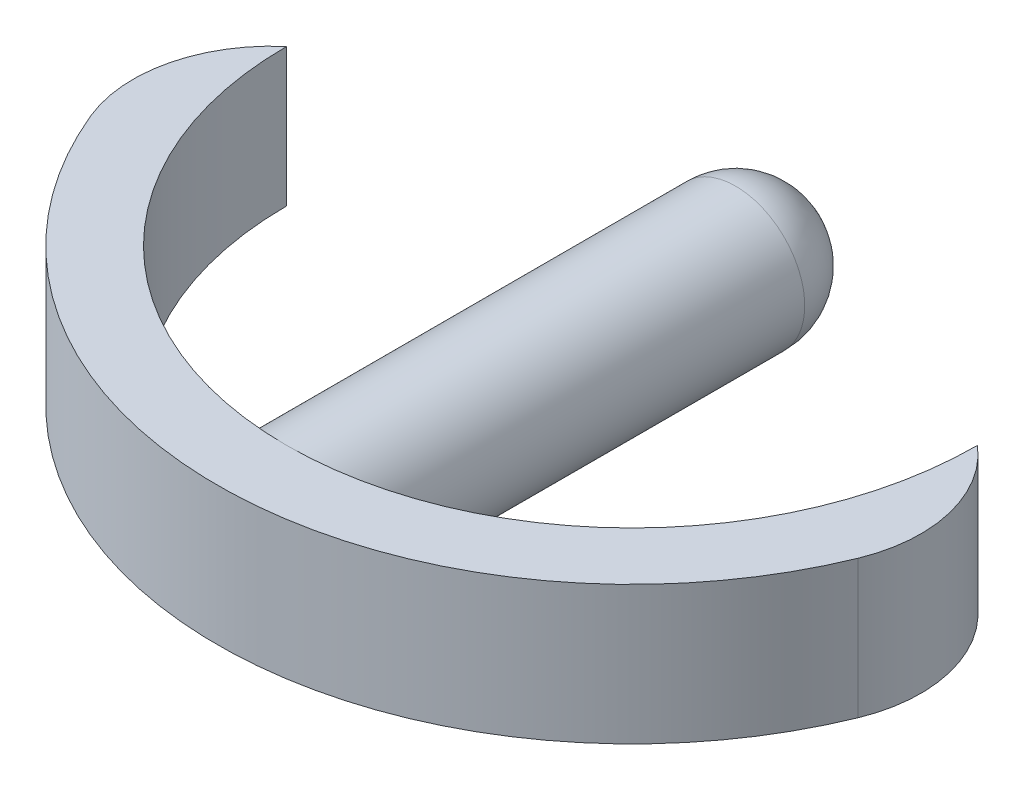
SolidWorks part; units mm, degrees
ref_plane "Front Plane" through (0, 0, 0) normal (0, 0, 1) x (1, 0, 0)
ref_plane "Top Plane" through (0, 0, 0) normal (0, 1, 0) x (1, 0, 0)
ref_plane "Right Plane" through (0, 0, 0) normal (1, 0, 0) x (0, 0, -1)
sketch "Sketch1" plane through (0, 0, 0) normal (0, 1, 0) x (1, 0, 0)
  circle A0 centre (0, 0) radius 7.62
  dimension "D1" = 15.24
extrude "Boss-Extrude1" add sketch "Sketch1" along normal blind 2.54
sketch "Sketch2" plane through (0, 2.54, 0) normal (0, 1, 0) x (1, 0, 0)
  line L0 (-7.62, 0) -> (7.62, 0)
  line L1 (-7.62, 0) -> (-7.62, 9.2593)
  line L2 (7.62, 0) -> (7.62, 9.2593)
  line L3 (-7.62, 9.2593) -> (7.62, 9.2593)
  circle A0 centre (0, 0) radius 7.62 construction
extrude "Cut-Extrude1" cut sketch "Sketch2" against normal through all
sketch "Sketch3" plane through (0, 2.54, 0) normal (0, 1, 0) x (1, 0, 0)
  line L0 (-7.62, 0) -> (7.62, 0) construction
  circle A0 centre (0, 0) radius 6.35
  dimension "D1" = 12.7
extrude "Cut-Extrude2" cut sketch "Sketch3" against normal through all
fillet "Fillet1" radius 2.54 2 edges at (-7.62, 1.27, 0) (7.62, 1.27, 0)
sketch "Sketch4" plane through (0, 0, 0) normal (0, 0, 1) x (1, 0, 0)
  line L0 (7.239, 0) -> (7.239, 2.54) construction
  circle A0 centre (0, 1.27) radius 1.27
  dimension "D2" = 2.54
  dimension "D1" = 1.27
  dimension "D3" = 7.239
extrude "Boss-Extrude2" add sketch "Sketch4" along normal up to body separate body
sketch "Sketch5" plane through (0, 0, 0) normal (0, 0, -1) x (-1, 0, 0)
  circle A0 centre (0, 1.27) radius 1.27
extrude "Boss-Extrude3" add sketch "Sketch5" along normal blind 3.175
fillet "Fillet2" radius 1.27 1 edges at (-1.27, 1.27, -3.175)
